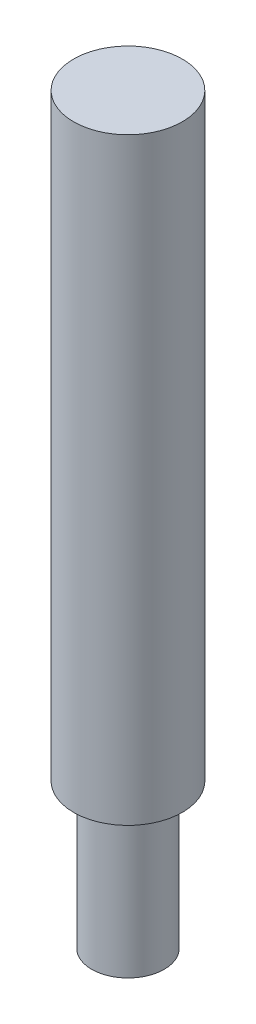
SolidWorks part; units mm, degrees
other "DetailItem3"
other "DetailItem4"
other "DetailItem5"
other "DetailItem6"
other "DetailItem7"
other "DetailItem8"
other "DetailItem9"
other "DetailItem10"
other "DetailItem11"
ref_plane "Front Plane" through (0, 0, 0) normal (0, 0, 1) x (1, 0, 0)
ref_plane "Top Plane" through (0, 0, 0) normal (0, 1, 0) x (1, 0, 0)
ref_plane "Right Plane" through (0, 0, 0) normal (1, 0, 0) x (0, 0, -1)
sketch "Sketch4" plane through (0, 0, 0) normal (1, 0, 0) x (0, 0, -1)
  line L0 (0, 0) -> (0, 3)
  line L1 (0, 3) -> (0, 4.5)
  line L2 (0, 4.5) -> (0, 6)
  line L3 (0, 6) -> (0, 7.5)
  line L4 (0, 7.5) -> (0, 9)
  line L5 (0, 9) -> (0, 10.5)
  line L6 (0, 10.5) -> (0, 12)
  line L7 (0, 12) -> (0, 13.5)
  line L8 (0, 13.5) -> (0, 16.5)
  line L9 (0, 16.5) -> (0, 19.5)
  line L10 (0, 19.5) -> (0, 21)
  line L11 (-1.5, 13.5) -> (1.5, 13.5)
  line L12 (-1.5, 19.5) -> (1.5, 19.5)
  line L13 (0, 21) -> (0, 22.5)
  line L14 (0, 22.5) -> (0, 24)
  line L15 (0, 24) -> (0, 27)
  line L16 (0, 0) -> (0, -3)
  line L17 (0, -3) -> (0, -4.5)
  line L18 (0, -4.5) -> (0, -6)
  line L19 (-1.5, -3) -> (1.5, -3)
  line L20 (-1.5, 3) -> (1.5, 3)
  dimension "D1" = 3
  dimension "D2" = 1.5
  dimension "D3" = 3
  dimension "D4" = 3
  dimension "D5" = 1.5
  dimension "D6" = 3
  dimension "D7" = 3
  dimension "D8" = 1.5
sketch "Sketch3" plane through (0, 0, 0) normal (0, 1, 0) x (1, 0, 0)
  circle A0 centre (1.5, 0) radius 1.5
  dimension "D1" = 3
extrude "Boss-Extrude2" add sketch "Sketch3" along normal up to vertex (16.5 mm away) contours A0
sketch "Sketch6" plane through (0, 0, 0) normal (1, 0, 0) x (0, 0, -1)
  line L1 (0, 9) -> (0, 10.5) construction
  line L2 (0.5, 3) -> (-0.5, 3)
  line L3 (0.5, 3) -> (0.5, 4.5)
  line L4 (0.5, 4.5) -> (-0.5, 4.5)
  line L5 (-0.5, 3) -> (-0.5, 4.5)
  line L6 (0.5, 3) -> (-0.5, 4.5) construction
  line L7 (0.5, 4.5) -> (-0.5, 3) construction
  point P0 (0, 3.75)
  dimension "D1" = 1
extrude "Cut-Extrude2" cut sketch "Sketch6" along normal blind 1
sketch "Sketch7" plane through (0, 0, 0) normal (0, -1, 0) x (-1, 0, 0)
  circle A0 centre (-1.5, 0) radius 1
  circle A1 centre (-1.5, 0) radius 1.5 construction
  dimension "D1" = 2
extrude "Boss-Extrude3" add sketch "Sketch7" along normal blind 4
